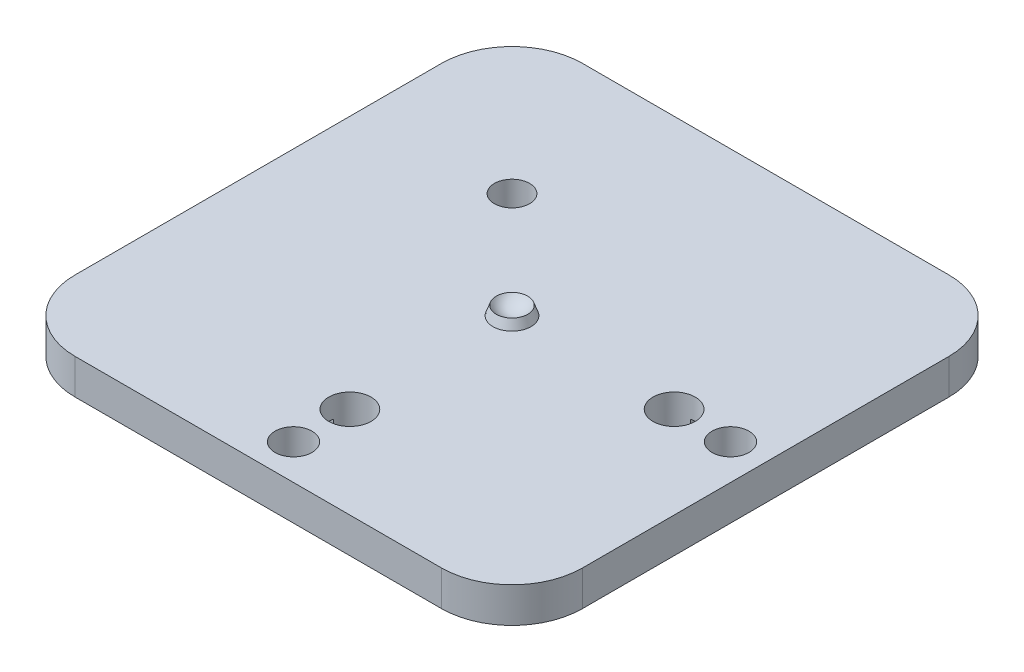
SolidWorks part; units mm, degrees
ref_plane "Front Plane" through (0, 0, 0) normal (0, 0, 1) x (1, 0, 0)
ref_plane "Top Plane" through (0, 0, 0) normal (0, 1, 0) x (1, 0, 0)
ref_plane "Right Plane" through (0, 0, 0) normal (1, 0, 0) x (0, 0, -1)
sketch "Sketch3" plane through (0, 0, 0) normal (0, 0, 1) x (1, 0, 0)
  line L3 (0, 0) -> (2.7, 0)
  line L4 (0, 0) -> (0, 2.8) construction
  line L5 (2.2332, 1.2825) -> (2.7, 0)
  line L6 (0, 0.1) -> (0, 0)
  arc A1 (0, 0.1) -> (2.2332, 1.2825) centre (0, 2.8) ccw
  dimension "D2" = 2.7
  dimension "D1" = 0.1
  dimension "D4" = 2.7
  dimension "D3" = 70
revolve "Revolve1" add sketch "Sketch3" angle 360 about L6
sketch "Sketch4" plane through (0, 0, 0) normal (0, -1, 0) x (1, 0, 0)
  line L0 (0, 0) -> (-36, 0) construction
  line L1 (-36, -36) -> (36, -36)
  line L2 (-36, -36) -> (-36, 36)
  line L3 (-36, 36) -> (36, 36)
  line L4 (36, -36) -> (36, 36)
  line L5 (-36, -36) -> (36, 36) construction
  line L6 (-36, 36) -> (36, -36) construction
  line L7 (0, 23) -> (0, 0) construction
  line L8 (0, 0) -> (23, 0) construction
  line L9 (0, 0) -> (0, 36) construction
  line L10 (-15, -15) -> (0, -15) construction
  line L11 (-15, -15) -> (-15, 0) construction
  circle A0 centre (23, 0) radius 3
  circle A1 centre (0, 23) radius 3
  circle A2 centre (-15, -15) radius 2.5
  circle A3 centre (0, 31) radius 2.625
  circle A4 centre (31, 0) radius 2.625
  point P0 (0, 0)
  dimension "D3" = 6
  dimension "D4" = 5
  dimension "D6" = 5.25
  dimension "D1" = 36
  dimension "D2" = 23
  dimension "D5" = 15
  dimension "D7" = 8
  dimension "D8" = 8
extrude "Boss-Extrude2" add sketch "Sketch4" along normal blind 5
sketch "Sketch5" plane through (0, -5, 0) normal (0, -1, 0) x (1, 0, 0)
  line L0 (-5.3, 23.6) -> (5.3, 23.6)
  line L1 (5.3, 23.6) -> (5.3, 22.4)
  line L2 (5.3, 22.4) -> (-5.3, 22.4)
  line L3 (-5.3, 22.4) -> (-5.3, 23.6)
  line L4 (22.4, 5.3) -> (23.6, 5.3)
  line L5 (23.6, 5.3) -> (23.6, -5.3)
  line L6 (23.6, -5.3) -> (22.4, -5.3)
  line L7 (22.4, -5.3) -> (22.4, 5.3)
  line L8 (-18.3234, -10.8281) -> (-10.8281, -18.3234)
  line L9 (-10.8281, -18.3234) -> (-11.6766, -19.1719)
  line L10 (-11.6766, -19.1719) -> (-19.1719, -11.6766)
  line L11 (-19.1719, -11.6766) -> (-18.3234, -10.8281)
  line L12 (-15, -15) -> (-15.4243, -15.4243) construction
  line L13 (-15, -15) -> (-14.5757, -14.5757) construction
  line L14 (-15, -15) -> (-18.7477, -11.2523) construction
  line L15 (-15, -15) -> (-11.2523, -18.7477) construction
  line L16 (-36, 36) -> (-36, -36) construction
  point P0 (0, 23)
  point P1 (23, 0)
  point P3 (-15, -15)
  point P16 (5.3, 23)
  point P19 (-5.3, 23)
  point P20 (0, 23.6)
  point P21 (0, 22.4)
  point P22 (22.4, 0)
  point P23 (23.6, 0)
  point P24 (23, 5.3)
  point P25 (23, -5.3)
  dimension "D1" = 10.6
  dimension "D2" = 1.2
  dimension "D3" = 135
extrude "Cut-Extrude1" cut sketch "Sketch5" against normal blind 2
sketch "Silhoutte for hex bolt M3 precision screws which need an 2.1 mm cut extrude" [suppressed] plane through (0, 0, 0) normal (0, 1, 0) x (1, 0, 0)
  line L0 (36, -36) -> (-36, -36) construction
  line L1 (1.8475, -27.8) -> (-1.8475, -27.8)
  line L2 (-1.8475, -27.8) -> (-3.695, -31)
  line L3 (-3.695, -31) -> (-1.8475, -34.2)
  line L4 (-1.8475, -34.2) -> (1.8475, -34.2)
  line L5 (1.8475, -34.2) -> (3.695, -31)
  line L6 (3.695, -31) -> (1.8475, -27.8)
  line L7 (34.2, 1.8475) -> (31, 3.695)
  line L8 (31, 3.695) -> (27.8, 1.8475)
  line L9 (27.8, 1.8475) -> (27.8, -1.8475)
  line L10 (27.8, -1.8475) -> (31, -3.695)
  line L11 (31, -3.695) -> (34.2, -1.8475)
  line L12 (34.2, -1.8475) -> (34.2, 1.8475)
  line L13 (36, 36) -> (36, -36) construction
  circle A0 centre (0, -31) radius 3.2 construction
  circle A1 centre (31, 0) radius 3.2 construction
  dimension "D1" = 6.4
fillet "Fillet1" radius 10 4 edges at (-36, -2.5, -36) (36, -2.5, -36) (-36, -2.5, 36) (36, -2.5, 36)
